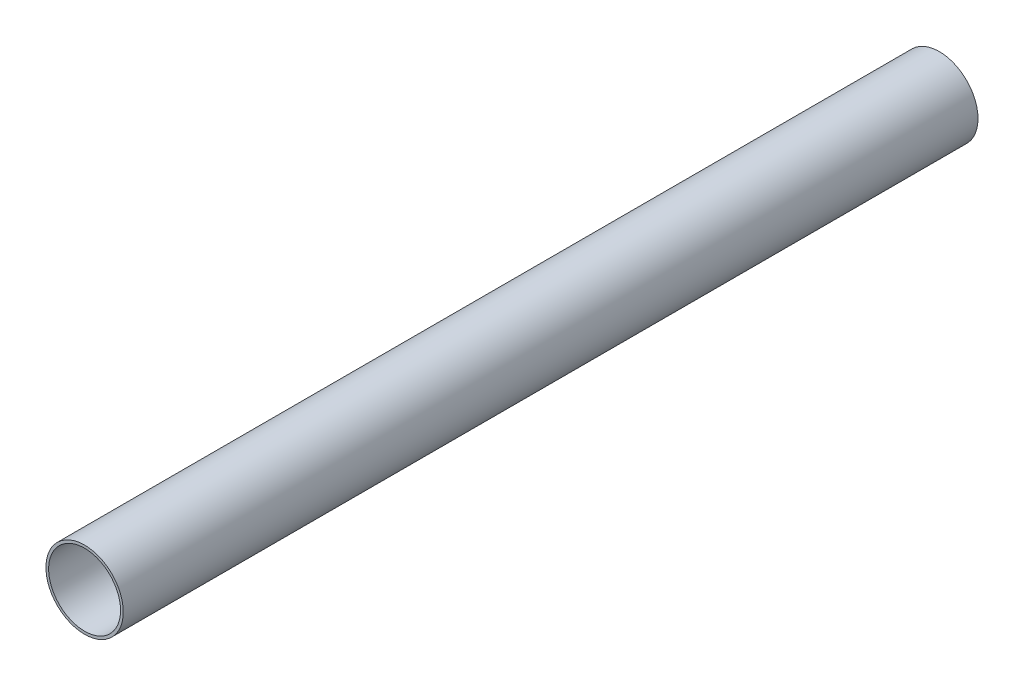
SolidWorks part; units mm, degrees
ref_plane "Front Plane" through (0, 0, 0) normal (0, 0, 1) x (1, 0, 0)
ref_plane "Top Plane" through (0, 0, 0) normal (0, 1, 0) x (1, 0, 0)
ref_plane "Right Plane" through (0, 0, 0) normal (1, 0, 0) x (0, 0, -1)
sketch "Sketch1" plane through (0, 0, 0) normal (0, 0, 1) x (1, 0, 0)
  circle A0 centre (0, 0) radius 27.051
  circle A1 centre (0, 0) radius 29.083
  dimension "D1" = 58.166
  dimension "D2" = 54.102
extrude "Extrude3" add sketch "Sketch1" along normal blind 642.9375
